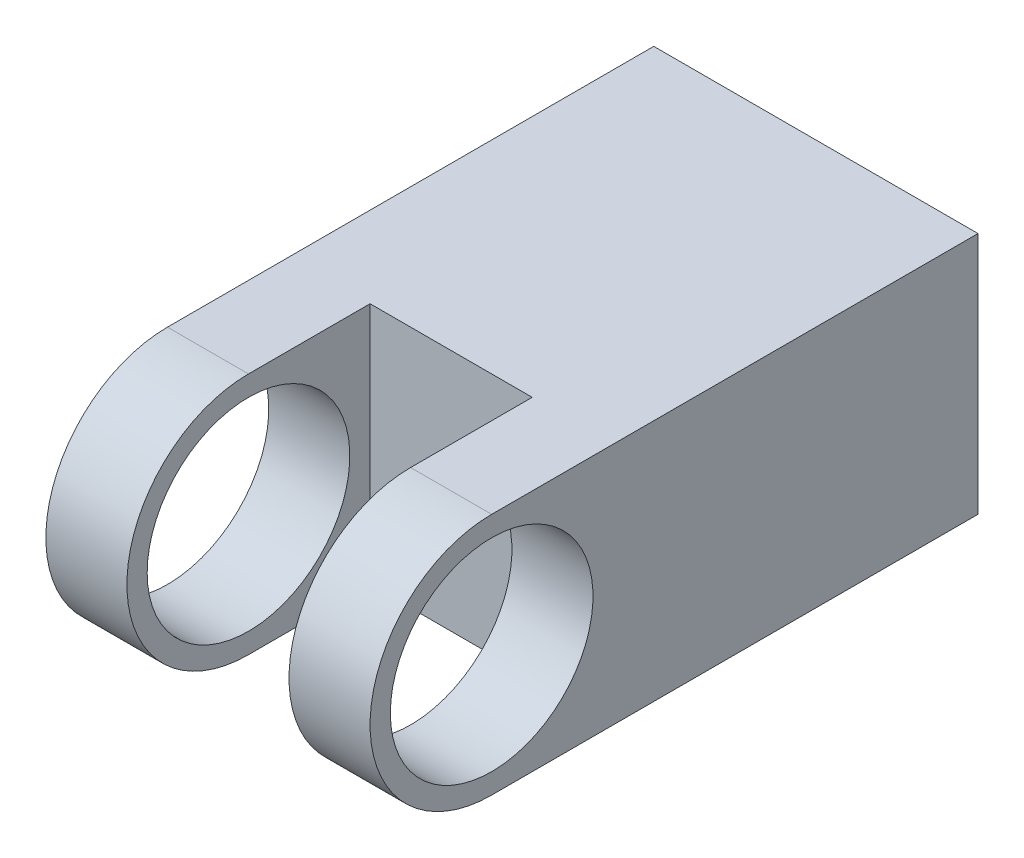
SolidWorks part; units mm, degrees
ref_plane "Front Plane" through (0, 0, 0) normal (0, 0, 1) x (1, 0, 0)
ref_plane "Top Plane" through (0, 0, 0) normal (0, 1, 0) x (1, 0, 0)
ref_plane "Right Plane" through (0, 0, 0) normal (1, 0, 0) x (0, 0, -1)
sketch "Sketch1" plane through (0, 0, 0) normal (0, 1, 0) x (1, 0, 0)
  line L1 (0, 0) -> (40, 0)
  line L2 (0, 0) -> (0, 45)
  line L3 (0, 45) -> (40, 45)
  line L4 (40, 0) -> (40, 45)
  dimension "D1" = 45
  dimension "D2" = 40
extrude "Boss-Extrude1" add sketch "Sketch1" along normal blind 30
sketch "Sketch2" plane through (0, 0, 0) normal (-1, 0, 0) x (0, 0, 1)
  line L5 (0, 30) -> (15, 30)
  line L6 (15, 0) -> (0, 0)
  line L7 (0, 30) -> (0, 0)
  arc A4 (15, 30) -> (15, 0) centre (15, 15) cw
  circle A5 centre (15, 15) radius 12.5
  dimension "D2" = 25
  dimension "D1" = 15
extrude "Boss-Extrude2" add sketch "Sketch2" against normal blind 10
ref_plane "Plane1" through (20, 0, 0) normal (1, 0, 0) x (0, 0, -1)
mirror "Mirror1" about plane through (20, 0, 0) normal (1, 0, 0) of "Boss-Extrude2"
